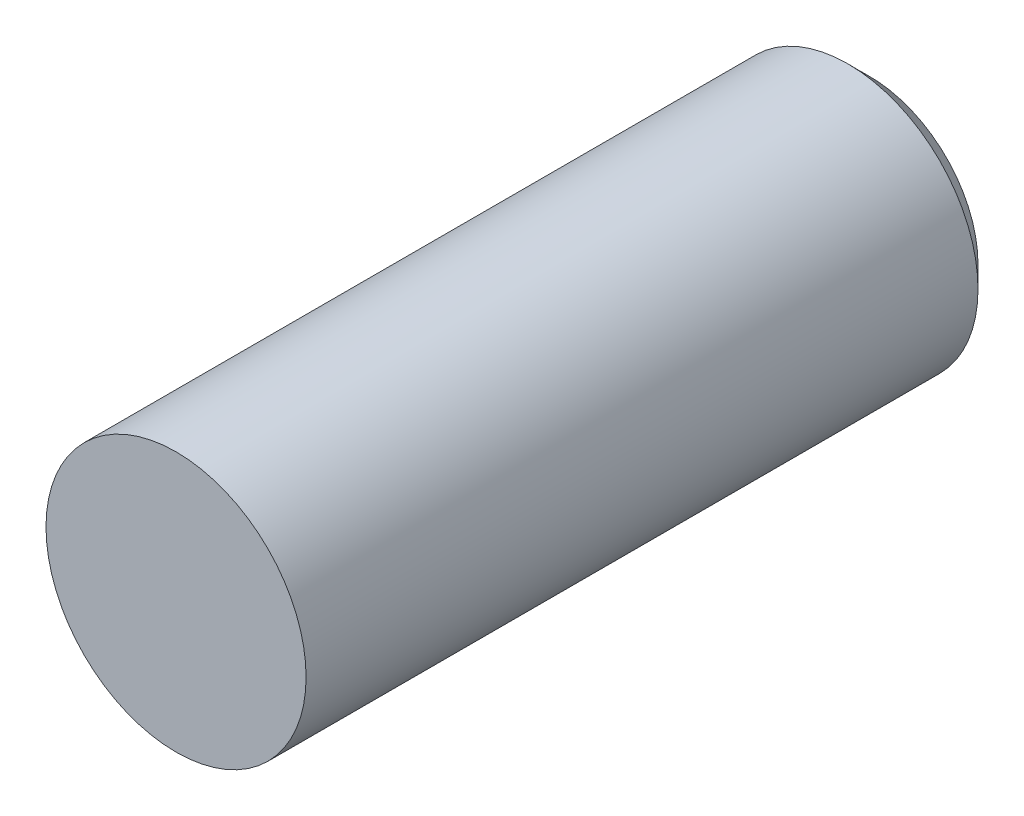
SolidWorks part; units mm, degrees
ref_plane "Front Plane" through (0, 0, 0) normal (1, 0, 0) x (0, 1, 0)
ref_plane "Top Plane" through (0, 0, 0) normal (0, 0, 1) x (0, 1, 0)
ref_plane "Right Plane" through (0, 0, 0) normal (0, 1, 0) x (-1, 0, 0)
sketch "Sketch1" plane through (0, 0, 0) normal (0, 0, 1) x (0, 1, 0)
  circle A0 centre (0, 0) radius 1.5
  dimension "D1" = 3
extrude "Boss-Extrude1" add sketch "Sketch1" along normal blind 8
chamfer "Chamfer1" distance 0.25 angle 45 1 edges at (1.5, 0, 0)
